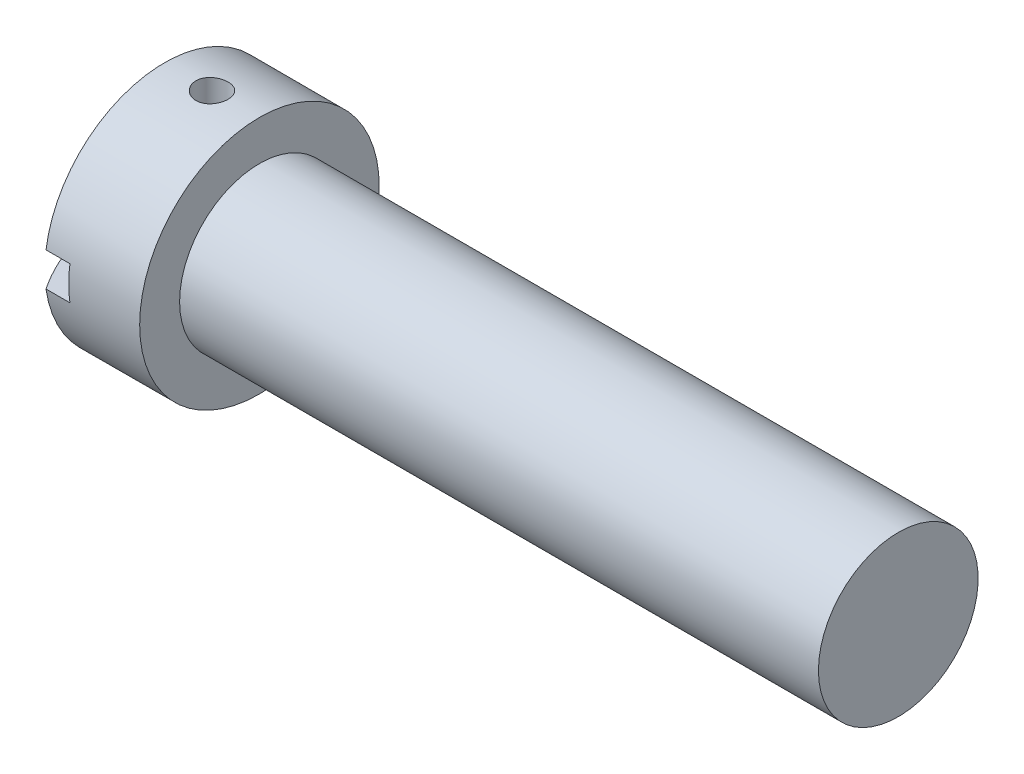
SolidWorks part; units mm, degrees
ref_plane "Plane1" through (0, 0, 0) normal (0, 0, 1) x (1, 0, 0)
ref_plane "Plane2" through (0, 0, 0) normal (0, 1, 0) x (1, 0, 0)
ref_plane "Plane3" through (0, 0, 0) normal (1, 0, 0) x (0, 0, -1)
sketch "BodySke" plane through (0, 0, 0) normal (0, 0, 1) x (1, 0, 0)
  line L0 (10.4648, 6.35) -> (10.4648, 9.525)
  line L1 (10.4648, 9.525) -> (2.921, 9.525)
  line L2 (-25.4, 0) -> (127, 0) construction
  line L3 (61.2648, 0) -> (0, 0)
  line L4 (10.4648, 6.35) -> (61.2648, 6.35)
  line L5 (61.2648, 6.35) -> (61.2648, 0)
  line L6 (10.4648, -9.525) -> (2.921, -9.525) construction
  line L7 (10.4648, -6.35) -> (61.2648, -6.35) construction
  line L8 (11.7348, 1.2192) -> (11.7348, -0.4698) construction
  line L9 (10.4648, 1.2192) -> (10.4648, -0.4698) construction
  arc A0 (0, 0) -> (2.921, 9.525) centre (16.9904, 0) cw
  dimension "Head_ht" = 10.4648
  dimension "Diameter" = 12.7
  dimension "Length" = 50.8
  dimension "Head_dia" = 19.05
  dimension "Head_side_ht" = 7.5438
  dimension "Advance" = 1.27
  dimension "Thread_nom" = 50.8
revolve "Base-Revolve" add sketch "BodySke" angle 360 about L2
sketch "Sketch2" plane through (0, 0, 0) normal (1, 0, 0) x (0, 0, -1)
  line L0 (-9.525, -1.3462) -> (-9.525, 1.3462)
  line L1 (-9.525, 1.3462) -> (9.525, 1.3462)
  line L2 (9.525, 1.3462) -> (9.525, -1.3462)
  line L3 (9.525, -1.3462) -> (-9.525, -1.3462)
  dimension "D1" = 19.05
  dimension "D2" = 9.525
  dimension "D3" = 1.3462
  dimension "Slot_width" = 2.6924
extrude "Slot" cut sketch "Sketch2" along normal blind 4.826
sketch "Sketch3" plane through (0, 0, 0) normal (1, 0, 0) x (0, 0, -1)
  line L0 (1.1557, -7.1374) -> (-1.1557, -7.1374)
  line L1 (1.1557, -7.1374) -> (1.1557, 7.1374)
  line L2 (-1.1557, 7.1374) -> (1.1557, 7.1374)
  line L3 (-1.1557, 7.1374) -> (-1.1557, -7.1374)
  dimension "D1" = 1.1557
  dimension "Cross_width" = 2.3114
  dimension "D2" = 7.1374
  dimension "Cross_dia" = 14.2748
ref_plane "Plane4" through (8.6106, 0, 0) normal (1, 0, 0) x (0, 0, -1)
sketch "Sketch4" plane through (8.6106, 0, 0) normal (1, 0, 0) x (0, 0, -1)
  line L0 (0.5778, -0.5778) -> (-0.5778, -0.5779)
  line L1 (0.5778, -0.5778) -> (0.5779, 0.5778)
  line L2 (-0.5778, 0.5778) -> (0.5779, 0.5778)
  line L3 (-0.5778, 0.5778) -> (-0.5778, -0.5779)
  dimension "D1" = 1.1557
  dimension "D2" = 0.5778
  dimension "D3" = 1.1557
  dimension "D4" = 0.5778
loft "Cross" [suppressed] cut profiles "Sketch3", "Sketch4"
pattern_circular "CirPattern1" [suppressed] count 2 every 90 about axis through (-25.4, 0, 0) along (1, 0, 0)
sketch "Sketch5" plane through (0, 0, 0) normal (0, 1, 0) x (1, 0, 0)
  line L4 (-25.4, 0) -> (127, 0) construction
  line L5 (10.4648, -6.312) -> (10.4648, 6.3337) construction
  circle A0 centre (7.2709, 0) radius 0.889
  dimension "Drilled_hole_dia" = 1.778
  dimension "D1" = 10.4648
  dimension "Drilled_hole_loc" = 3.1939
extrude "Hole" [suppressed] cut sketch "Sketch5" against normal through all and the other way through all
sketch "ThdSchSke" plane through (0, 0, 0) normal (0, 0, 1) x (1, 0, 0)
  line L0 (11.7348, -5.5943) -> (11.2057, -6.35)
  line L1 (11.7348, -5.5943) -> (12.2639, -6.35)
  line L2 (12.2639, -6.35) -> (12.2639, -7.9375)
  line L3 (-3.175, 0) -> (5.1513, 0) construction
  line L5 (12.2639, -7.9375) -> (11.2057, -7.9375)
  line L6 (11.2057, -7.9375) -> (11.2057, -6.35)
  dimension "Thread_minor" = 11.1887
  dimension "Diameter" = 12.7
  dimension "Start" = 11.7348
  dimension "SideAngle" = 55
  dimension "VeeAngle" = 70
  dimension "Overcut" = 15.875
revolve "ThreadSchematic" [suppressed] cut sketch "ThdSchSke" angle 360 about L3
pattern_linear "ThdSchPat" [suppressed]
sketch "Sketch6" plane through (0, 0, 0) normal (0, 1, 0) x (1, 0, 0)
  line L0 (2.921, 0) -> (10.4648, 0) construction
  line L1 (2.921, -9.4294) -> (2.921, 9.4294) construction
  line L2 (10.4648, -6.35) -> (10.4648, 6.35) construction
  circle A0 centre (6.6929, 0) radius 1.2789
  dimension "D1" = 2.5578
extrude "Cut-Extrude1" cut sketch "Sketch6" against normal mid plane 1271.524
equation "\"D1@Sketch3\" = \"Cross_width@Sketch3\" / 2"
equation "\"D2@Sketch3\" = \"Cross_dia@Sketch3\" / 2"
equation "\"D1@Sketch4\" = \"Cross_width@Sketch3\"*.5"
equation "\"D2@Sketch4\" = \"D1@Sketch4\" / 2"
equation "\"D3@Sketch4\" = \"D1@Sketch4\""
equation "\"D4@Sketch4\" = \"D2@Sketch4\""
equation "\"D1@Sketch2\" = \"Head_dia@BodySke\""
equation "\"D2@Sketch2\" = \"D1@Sketch2\" / 2"
equation "\"D3@Sketch2\" = \"Slot_width@Sketch2\" / 2"
equation "\"D1@Sketch5\" = \"Head_ht@BodySke\""
equation "\"Thread_length@ThreadCosmetic\" = ((sgn( (\"Length@BodySke\" - \"Advance@BodySke\" ) - \"Thread_nom@BodySke\" )-1)*( (\"Length@BodySke\" - \"Advance@BodySke\" ) - \"Thread_nom@BodySke\" ))/-2+ \"Thread_nom@BodySke\""
equation "\"Thread_minor@ThdSchSke\" = \"Thread_minor@ThreadCosmetic\""
equation "\"Diameter@ThdSchSke\" = \"Diameter@BodySke\""
equation "\"Overcut@ThdSchSke\" = \"Diameter@BodySke\" * 1.25"
equation "\"Start@ThdSchSke\" = \"Head_ht@BodySke\" + \"Length@BodySke\" - \"Thread_length@ThreadCosmetic\"  '---Non-countersunk---"
equation "\"Num_threads@ThdSchPat\" = int( \"Thread_length@ThreadCosmetic\" / \"Advance@BodySke\" + 0.999 )  + 1"
equation "\"Advance@ThdSchPat\" = \"Thread_length@ThreadCosmetic\" /  (\"Num_threads@ThdSchPat\" - 1) 'relax it"
equation "\"D1@Sketch6\" = \"Slot_width@Sketch2\"*0.95"
